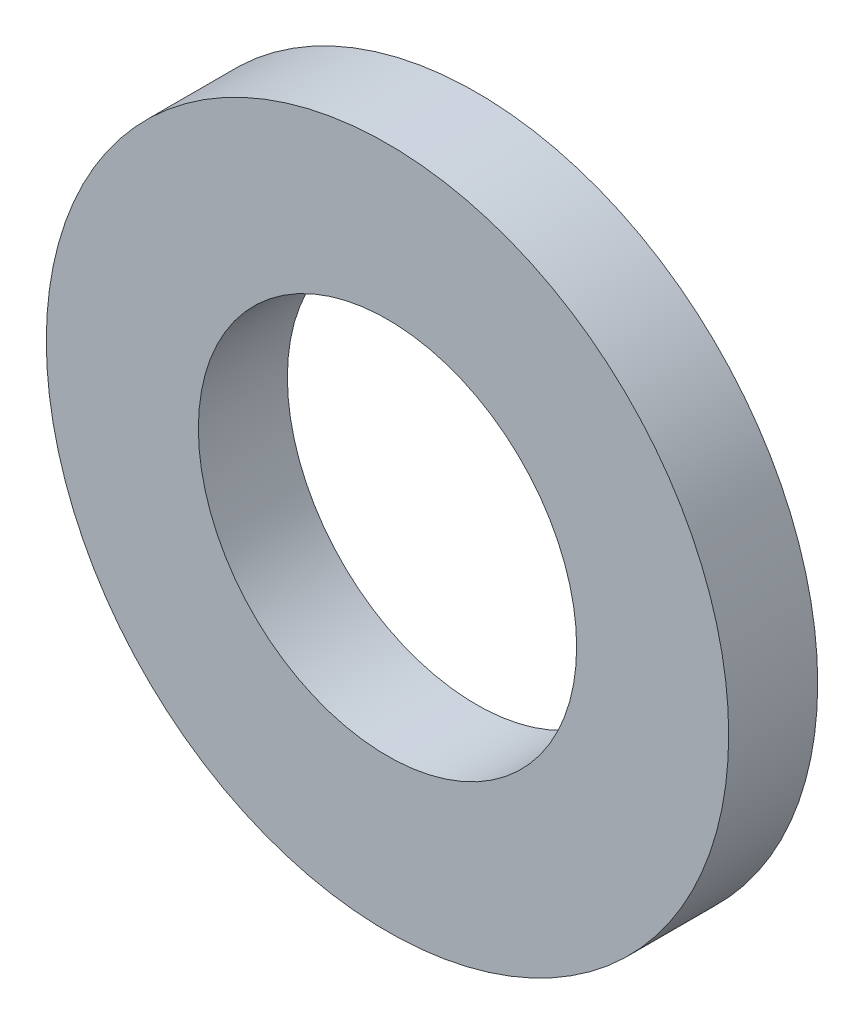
SolidWorks part; units mm, degrees
ref_plane "Vorne" through (0, 0, 0) normal (0, 0, 1) x (1, 0, 0)
ref_plane "Oben" through (0, 0, 0) normal (0, 1, 0) x (1, 0, 0)
ref_plane "Rechts" through (0, 0, 0) normal (1, 0, 0) x (0, 0, -1)
sketch "Skizze1" plane through (0, 0, 0) normal (0, 0, 1) x (1, 0, 0)
  circle A0 centre (0, 0) radius 4.6
  circle A1 centre (0, 0) radius 2.55
  dimension "D1" = 5.1
  dimension "d" = 9.2
extrude "Linear austragen1" add sketch "Skizze1" along normal blind 1.2
